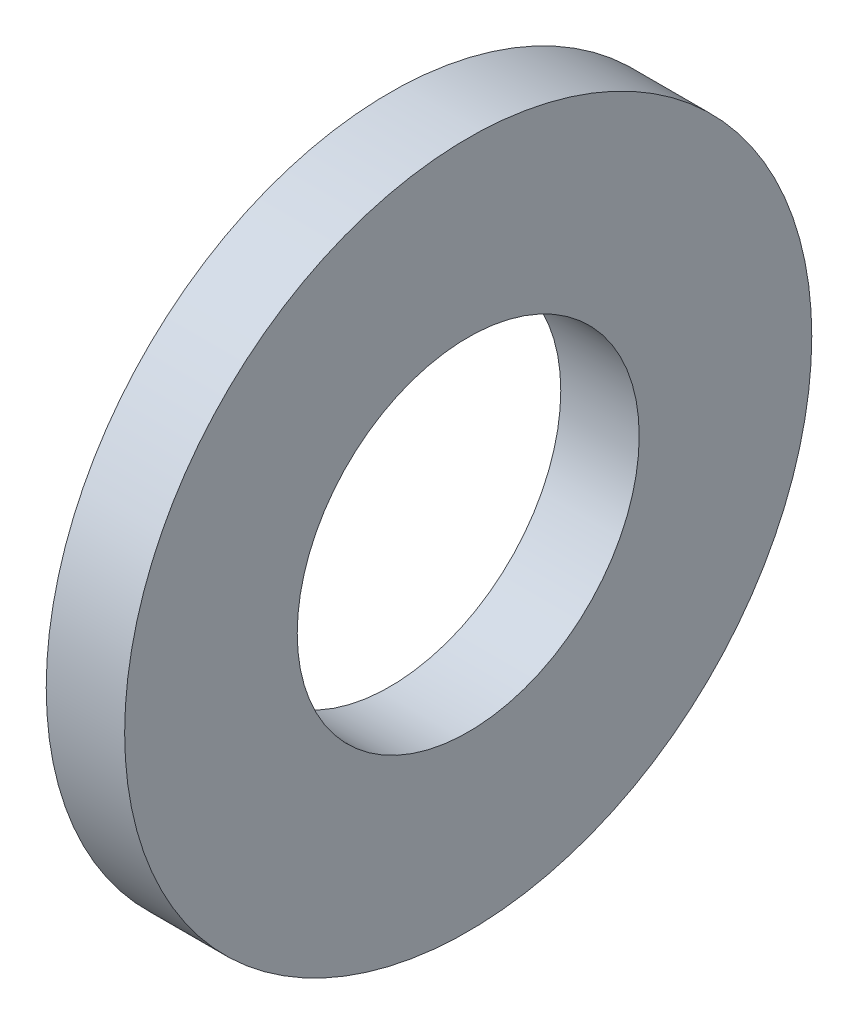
SolidWorks part; units mm, degrees
ref_plane "Plane1" through (0, 0, 0) normal (0, 0, 1) x (1, 0, 0)
ref_plane "Plane2" through (0, 0, 0) normal (0, 1, 0) x (1, 0, 0)
ref_plane "Plane3" through (0, 0, 0) normal (1, 0, 0) x (0, 0, -1)
revolve "Base-Revolve" add sketch "Sketch1" angle 360 about L0
sketch "Sketch1" plane through (0, 0, 0) normal (0, 0, 1) x (1, 0, 0)
  line L0 (-34.925, 0) -> (9.525, 0) construction
  line L1 (0, 1.3843) -> (0, 2.7813)
  line L2 (0, 2.7813) -> (-0.635, 2.7813)
  line L3 (-0.635, 2.7813) -> (-0.635, 1.3843)
  line L4 (-0.635, 1.3843) -> (0, 1.3843)
  dimension "Thickness" = 0.635
  dimension "Inside_dia" = 2.7686
  dimension "Outside_dia" = 5.5626
